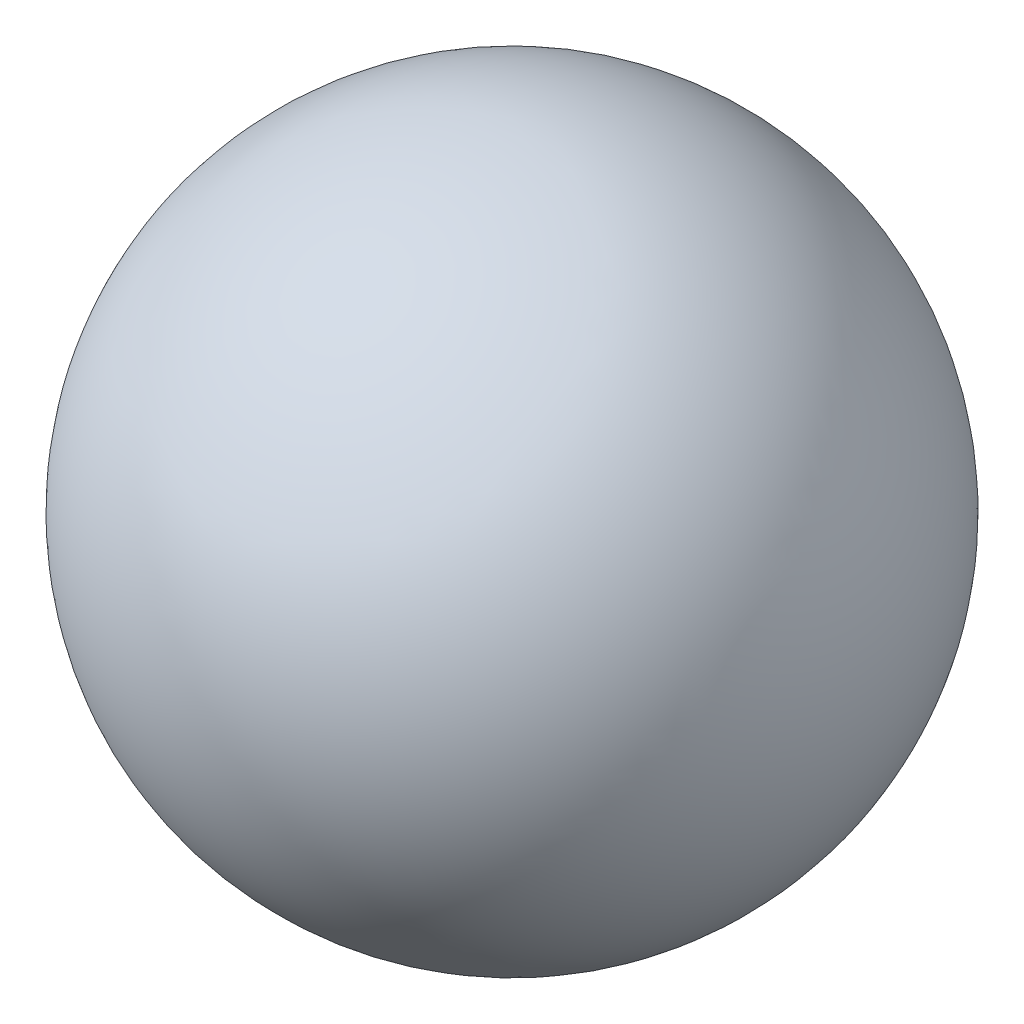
SolidWorks part; units mm, degrees
ref_plane "Plan1" through (0, 0, 0) normal (0, 0, 1) x (1, 0, 0)
ref_plane "Plan2" through (0, 0, 0) normal (0, 1, 0) x (1, 0, 0)
ref_plane "Plan3" through (0, 0, 0) normal (1, 0, 0) x (0, 0, -1)
sketch "Esquisse1" plane through (0, 0, 0) normal (0, 1, 0) x (1, 0, 0)
  line L1 (-7.25, 0) -> (20.75, 0) construction
  line L4 (-6.25, 0) -> (6.25, 0)
  line L5 (-6.25, 0) -> (6.75, 0) construction
  line L6 (6.75, 12.5) -> (6.75, -12.5) construction
  circle A2 centre (0, 0) radius 6.25 construction
  arc A3 (6.25, 0) -> (-6.25, 0) centre (0, 0) ccw
revolve "Base-Révolution" add sketch "Esquisse1" angle 360 about L5
